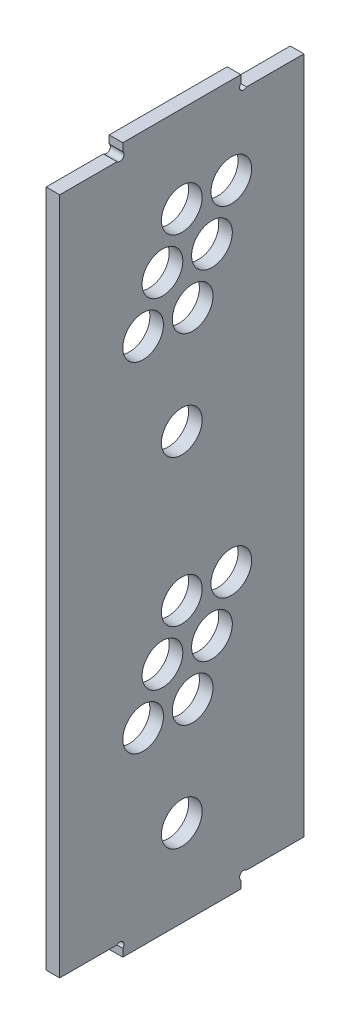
SolidWorks part; units mm, degrees
ref_plane "Alzado" through (0, 0, 0) normal (0, 0, 1) x (1, 0, 0)
ref_plane "Planta" through (0, 0, 0) normal (0, 1, 0) x (1, 0, 0)
ref_plane "Vista lateral" through (0, 0, 0) normal (1, 0, 0) x (0, 0, -1)
sketch "Croquis3" plane through (-182.6952, 0, 0) normal (-1, 0, 0) x (0, 0, 1)
  line L0 (0, 500) -> (0, 0)
  line L1 (0, 500) -> (-180, 500)
  line L2 (0, 0) -> (-180, 0)
  line L3 (-180, 500) -> (-180, 0)
  point P0 (0, 0)
  dimension "D1" = 180
extrude "Saliente-Extruir1" add sketch "Croquis3" along normal blind 10
sketch "Croquis5" plane through (-192.6952, 0, 0) normal (-1, 0, 0) x (0, 0, 1)
  line L0 (-180, 250) -> (0, 250) construction
  line L1 (-180, 500) -> (-180, 0) construction
  line L2 (0, 0) -> (0, 500) construction
  line L3 (-90, 54) -> (-90, 0) construction
  line L4 (-180, 0) -> (0, 0) construction
  line L5 (-90, 196) -> (-90, 250) construction
  line L6 (0, 54) -> (-180, 54) construction
  circle A0 centre (-90, 54) radius 15
  circle A1 centre (-98, 129) radius 15
  circle A2 centre (-112.25, 162.5) radius 15
  circle A3 centre (-126.5, 196) radius 15
  circle A4 centre (-75.75, 162.5) radius 15
  circle A5 centre (-90, 196) radius 15
  circle A8 centre (-61.5, 129) radius 15
  point P12 (-90, 54)
  dimension "D1" = 30
  dimension "D2" = 75
  dimension "D3" = 8
  dimension "D4" = 33.5
  dimension "D5" = 14.25
  dimension "D6" = 14.25
  dimension "D7" = 33.5
  dimension "D8" = 36.5
  dimension "D10" = 14.25
  dimension "D11" = 36.5
extrude "Cortar-Extruir2" cut sketch "Croquis5" against normal through all both and the other way through all
pattern_linear "MatrizL1" count 2 spacing 250 along (0, 1, 0) of "Cortar-Extruir2"
sketch "Croquis6" plane through (0, 0, 0) normal (0, -1, 0) x (1, 0, 0)
  line L0 (-192.6952, -46.5) -> (-182.6952, -46.5)
  line L1 (-192.6952, -46.5) -> (-192.6952, -133.5)
  line L2 (-182.6952, -46.5) -> (-182.6952, -133.5)
  line L3 (-192.6952, -133.5) -> (-182.6952, -133.5)
  line L4 (-182.6952, -180) -> (-182.6952, 0) construction
  line L5 (-192.6952, -90) -> (-182.6952, -90) construction
  line L6 (-192.6952, -180) -> (-192.6952, 0) construction
  point P11 (-192.6952, -90)
extrude "Saliente-Extruir2" add sketch "Croquis6" along normal blind 10
sketch "Croquis7" plane through (-192.6952, 0, 0) normal (-1, 0, 0) x (0, 0, 1)
  line L0 (-133.5, -2.1213) -> (-135.6213, -2.1213) construction
  line L1 (-133.5, -10) -> (-133.5, 0) construction
  line L2 (-44.3787, -2.1213) -> (-44.3787, 0) construction
  line L3 (-135.6213, -2.1213) -> (-135.6213, 0) construction
  line L4 (-180, 0) -> (-133.5, 0) construction
  line L5 (-90, -10) -> (-90, 19.4015) construction
  line L6 (-46.5, -10) -> (-133.5, -10) construction
  line L7 (-46.5, -2.1213) -> (-44.3787, -2.1213) construction
  circle A0 centre (-135.6213, -2.1213) radius 3
  circle A2 centre (-44.3787, -2.1213) radius 3
  dimension "D1" = 6
extrude "Cortar-Extruir3" cut sketch "Croquis7" against normal through all
ref_plane "Plano1" through (0, 250, 0) normal (0, -1, 0) x (-1, 0, 0)
mirror "Simetría1" about plane through (0, 250, 0) normal (0, -1, 0) of "Saliente-Extruir2", "Cortar-Extruir3"
